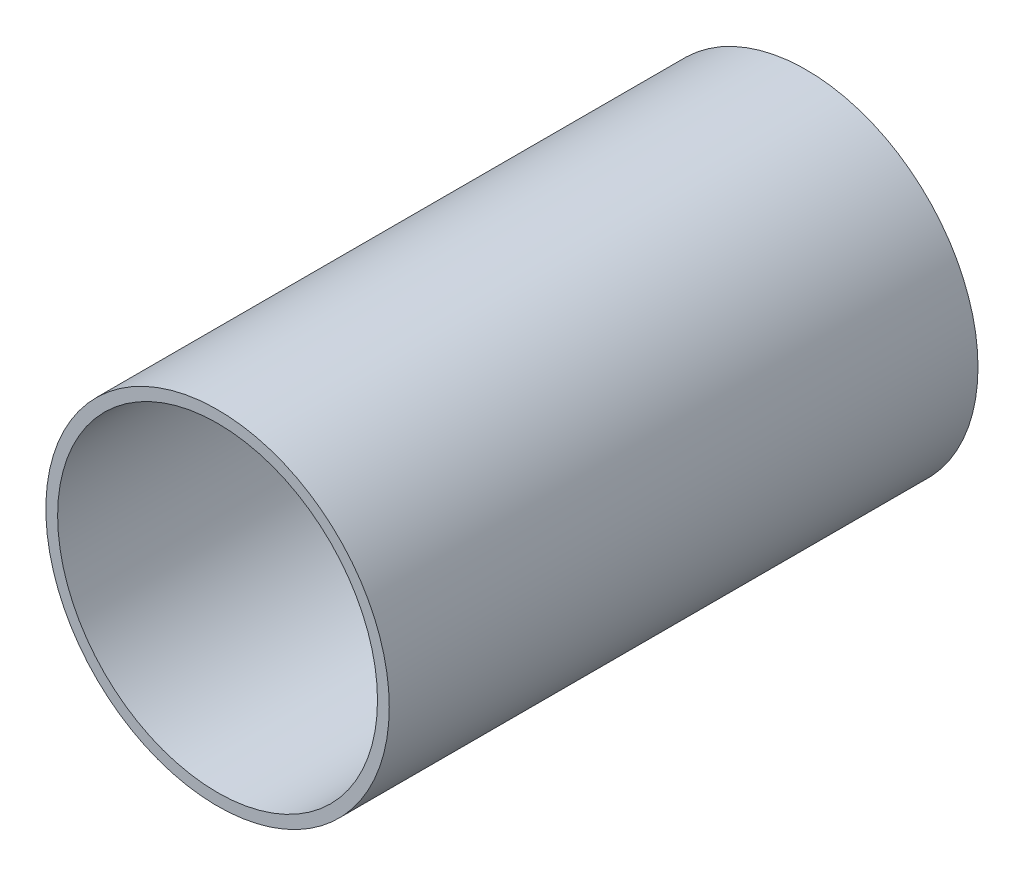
SolidWorks part; units mm, degrees
ref_plane "Front Plane" through (0, 0, 0) normal (0, 0, 1) x (1, 0, 0)
ref_plane "Top Plane" through (0, 0, 0) normal (0, 1, 0) x (1, 0, 0)
ref_plane "Right Plane" through (0, 0, 0) normal (1, 0, 0) x (0, 0, -1)
sketch "Sketch1" plane through (0, 0, 0) normal (0, 0, 1) x (1, 0, 0)
  circle A0 centre (0, 0) radius 41.402
  circle A1 centre (0, 0) radius 44.45
  dimension "D1" = 82.804
  dimension "D2" = 3.048
extrude "Boss-Extrude1" add sketch "Sketch1" against normal blind 152.4
